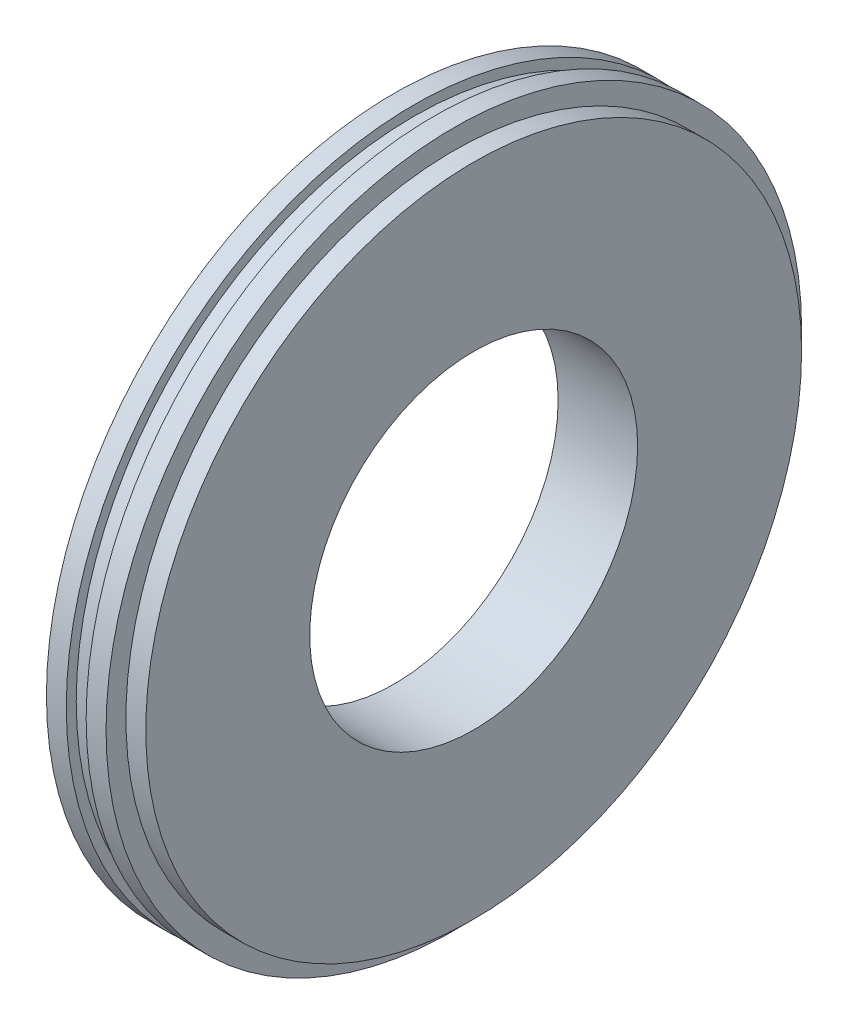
SolidWorks part; units mm, degrees
ref_plane "Front Plane" through (0, 0, 0) normal (0, 0, 1) x (1, 0, 0)
ref_plane "Top Plane" through (0, 0, 0) normal (0, 1, 0) x (1, 0, 0)
ref_plane "Right Plane" through (0, 0, 0) normal (1, 0, 0) x (0, 0, -1)
ref_axis "Axis1" through (8.4, 0, 0) along (-1, 0, 0)
sketch "Sketch11" plane through (0, 0, 0) normal (0, 0, 1) x (1, 0, 0)
  line L0 (0, 16.5) -> (0, 35)
  line L1 (0, 35) -> (2, 35)
  line L2 (2, 35) -> (2, 34)
  line L3 (2, 34) -> (4, 34)
  line L4 (4, 34) -> (4, 35)
  line L5 (4, 35) -> (6, 35)
  line L6 (6, 35) -> (6, 33)
  line L7 (6, 33) -> (8, 33)
  line L8 (8, 33) -> (8, 16.5)
  line L9 (8, 16.5) -> (0, 16.5)
  point P7 (2, 34.5)
  dimension "D1" = 16.5
  dimension "D2" = 33
  dimension "D3" = 35
  dimension "D4" = 8
  dimension "D5" = 2
  dimension "D6" = 1
  dimension "D7" = 2
  dimension "D8" = 2
revolve "Revolve1" add sketch "Sketch11" angle 360 about axis through (8.4, 0, 0) along (-1, 0, 0)
